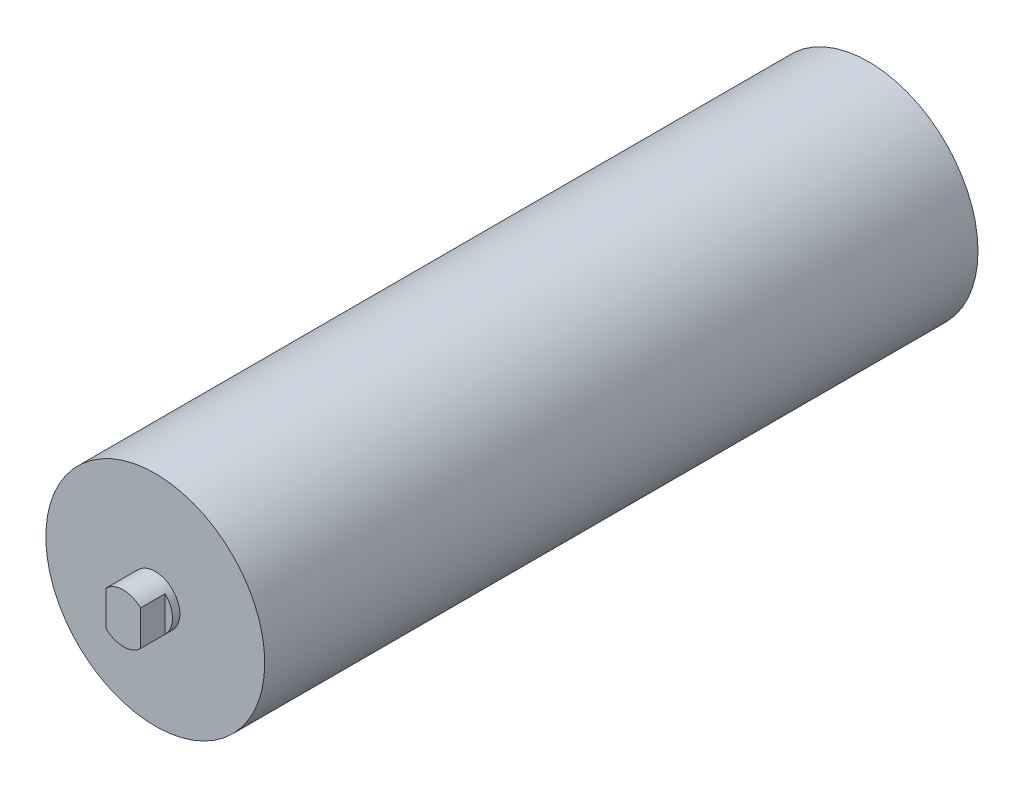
SolidWorks part; units mm, degrees
ref_plane "Front" through (0, 0, 0) normal (0, 0, 1) x (1, 0, 0)
ref_plane "Top" through (0, 0, 0) normal (0, 1, 0) x (1, 0, 0)
ref_plane "Right" through (0, 0, 0) normal (1, 0, 0) x (0, 0, -1)
sketch "Esquisse1" plane through (0, 0, 0) normal (0, 0, 1) x (1, 0, 0)
  circle A0 centre (0, 0) radius 44.5
  dimension "D2" = 89
extrude "Base-Extrusion" add sketch "Esquisse1" along normal blind 290
sketch "Esquisse2" plane through (0, 0, 290) normal (0, 0, 1) x (1, 0, 0)
  circle A0 centre (0, 0) radius 10
  dimension "D1" = 20
extrude "Boss.-Extru.1" add sketch "Esquisse2" along normal blind 13
sketch "Esquisse3" plane through (0, 0, 0) normal (0, 0, -1) x (-1, 0, 0)
  circle A0 centre (0, 0) radius 10
  dimension "D1" = 20
extrude "Boss.-Extru.2" add sketch "Esquisse3" along normal blind 13
sketch "Esquisse5" plane through (0, 0, -13) normal (0, 0, -1) x (-1, 0, 0)
  line L1 (-7, 20.2682) -> (7, 20.2682)
  line L2 (-7, 20.2682) -> (-7, -17.3308)
  line L3 (-7, -17.3308) -> (7, -17.3308)
  line L4 (7, 20.2682) -> (7, -17.3308)
  dimension "D1" = 14
  dimension "D2" = 7
extrude "Enlèv. mat.-Extru.1" cut sketch "Esquisse5" against normal blind 10 flip side to cut
sketch "Esquisse6" plane through (0, 0, 303) normal (0, 0, 1) x (1, 0, 0)
  line L1 (-7, 19.7787) -> (7, 19.7787)
  line L2 (-7, 19.7787) -> (-7, -20.0724)
  line L3 (-7, -20.0724) -> (7, -20.0724)
  line L4 (7, 19.7787) -> (7, -20.0724)
  dimension "D1" = 14
  dimension "D2" = 7
extrude "Enlèv. mat.-Extru.2" cut sketch "Esquisse6" against normal blind 10 flip side to cut
